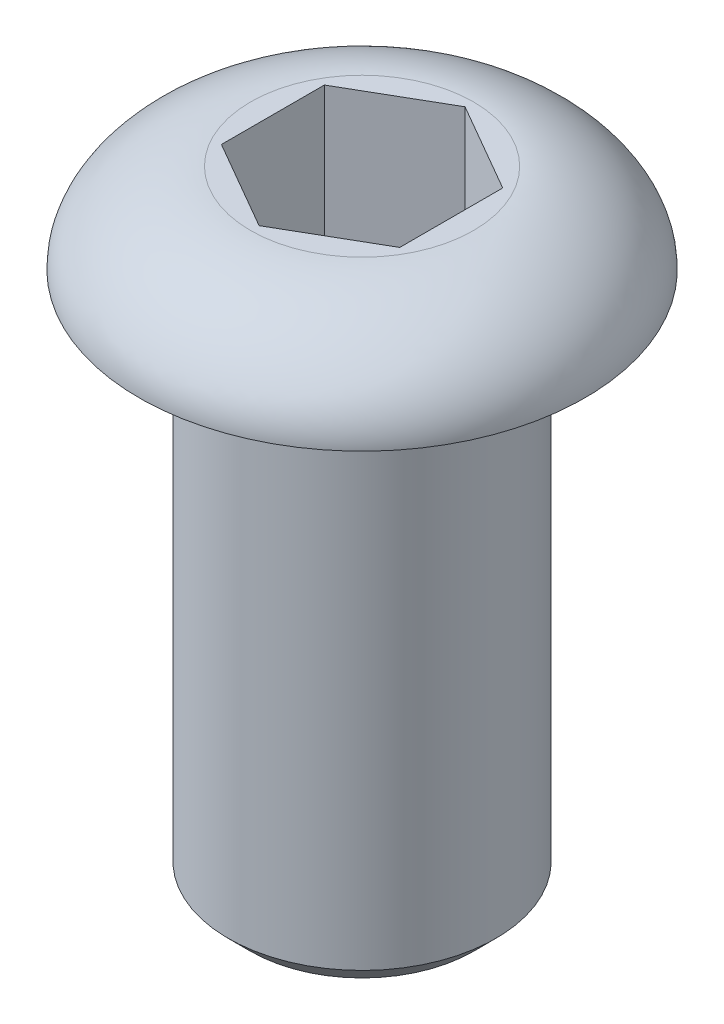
SolidWorks part; units mm, degrees
ref_plane "Front" through (0, 0, 0) normal (0, 0, 1) x (1, 0, 0)
ref_plane "Top" through (0, 0, 0) normal (0, 1, 0) x (1, 0, 0)
ref_plane "Right" through (0, 0, 0) normal (1, 0, 0) x (0, 0, -1)
sketch "Esquisse1" plane through (0, 0, 0) normal (0, 0, 1) x (1, 0, 0)
  line L0 (0, -12) -> (2.5, -12)
  line L1 (0, -50) -> (0, 50) construction
  line L2 (3, -11.5) -> (3, 0)
  line L3 (50, 0) -> (-50, 0) construction
  line L6 (0, 2) -> (0, -12)
  line L7 (2.5, -12) -> (3, -11.5)
  line L8 (3, 0) -> (5, 0)
  line L9 (0, 2) -> (2.5, 2)
  line L10 (5, 0) -> (5, -1.7358) construction
  spline S0 degree 3 poles (2.5, 2) (3.5672, 2) (5, 1.0672) (5, 0) knots 0 0 0 0 1 1 1 1
  point P1 (3, -12)
  dimension "D1" = 12
  dimension "D2" = 2
  dimension "D3" = 3
  dimension "D4" = 2.5
  dimension "D5" = 5
revolve "Révolution1" add sketch "Esquisse1" angle 360 about L6
sketch "Esquisse3" plane through (0, 0, 0) normal (0, 1, 0) x (1, 0, 0)
  line L0 (0, -50) -> (0, 50) construction
  line L1 (0, -2.3094) -> (2, -1.1547)
  line L2 (2, -1.1547) -> (2, 1.1547)
  line L3 (2, 1.1547) -> (0, 2.3094)
  line L4 (0, 2.3094) -> (-2, 1.1547)
  line L5 (-2, 1.1547) -> (-2, -1.1547)
  line L6 (-2, -1.1547) -> (0, -2.3094)
  circle A0 centre (0, 0) radius 2 construction
  dimension "D1" = 4
extrude "Enlèv. mat.-Extru.1" cut sketch "Esquisse3" along normal through all and the other way blind 1
